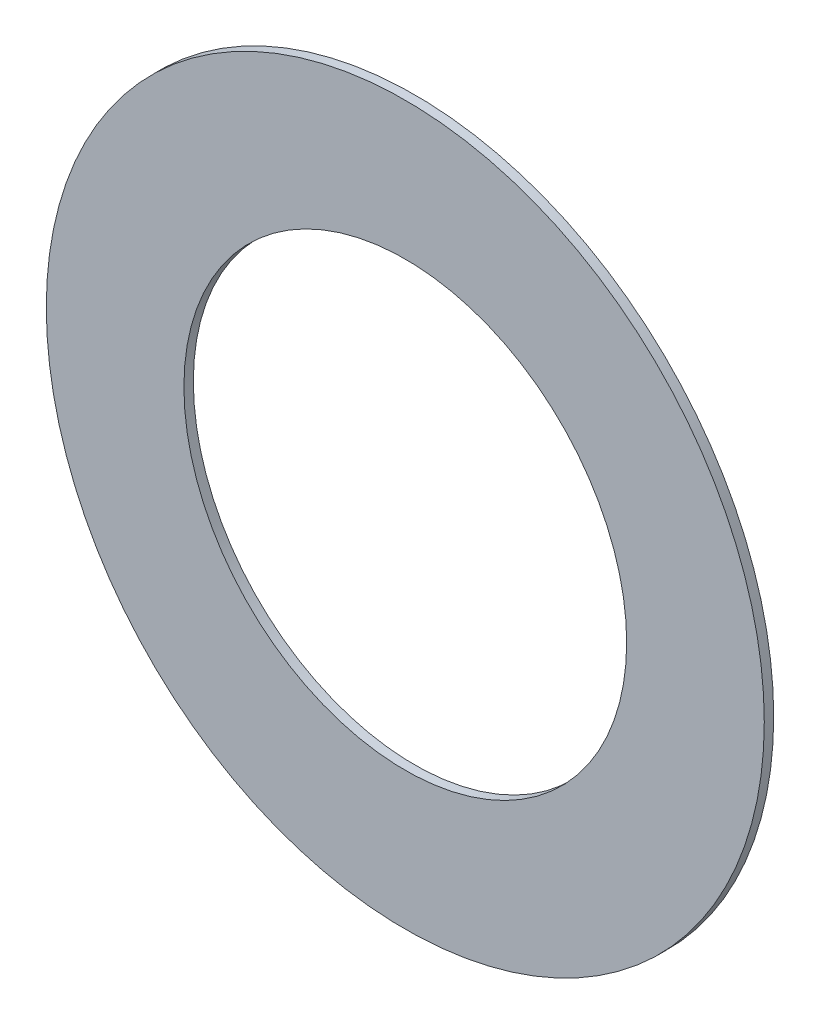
SolidWorks part; units mm, degrees
ref_plane "Front Plane" through (0, 0, 0) normal (0, 0, 1) x (1, 0, 0)
ref_plane "Top Plane" through (0, 0, 0) normal (0, 1, 0) x (1, 0, 0)
ref_plane "Right Plane" through (0, 0, 0) normal (1, 0, 0) x (0, 0, -1)
sketch "Sketch1" plane through (0, 0, 0) normal (0, 0, 1) x (1, 0, 0)
  circle A0 centre (0, 0) radius 23.495
  circle A1 centre (0, 0) radius 38.1
  dimension "D1" = 76.2
  dimension "D2" = 46.99
extrude "Boss-Extrude1" add sketch "Sketch1" along normal blind 1
